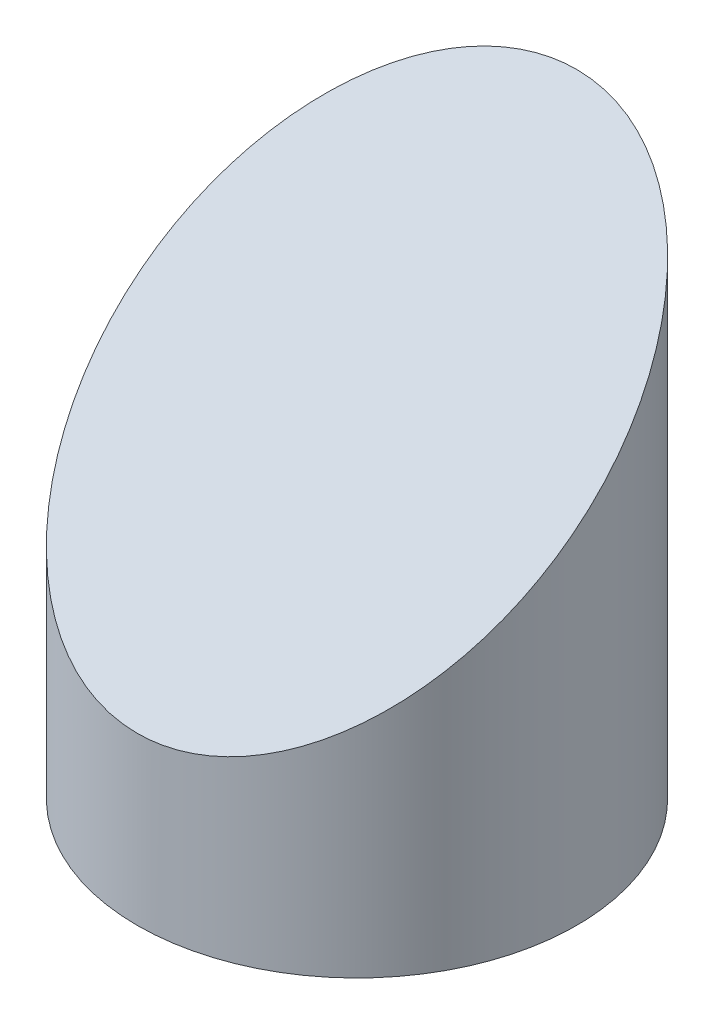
SolidWorks part; units mm, degrees
ref_plane "前视基准面" through (0, 0, 0) normal (0, 0, 1) x (1, 0, 0)
ref_plane "上视基准面" through (0, 0, 0) normal (0, 1, 0) x (1, 0, 0)
ref_plane "右视基准面" through (0, 0, 0) normal (1, 0, 0) x (0, 0, -1)
sketch "草图1" plane through (0, 0, 0) normal (1, 0, 0) x (0, 0, -1)
  line L0 (0, 0) -> (0, 70.9678) construction
  line L1 (0, 0) -> (25, 0)
  line L2 (25, 0) -> (25, 80)
  line L3 (25, 80) -> (0, 80)
  line L4 (0, 80) -> (0, 0)
  dimension "D1" = 80
  dimension "D2" = 25
revolve "旋转1" add sketch "草图1" angle 360 about L0
sketch "草图3" plane through (0, 0, 0) normal (1, 0, 0) x (0, 0, -1)
  line L0 (25, 59.3874) -> (-25, 18.9355)
  line L1 (25, 0) -> (25, 80) construction
  line L2 (-25, 80) -> (-25, 0) construction
  line L3 (-25, 18.9355) -> (-25, 91.3478)
  line L4 (-25, 91.3478) -> (25, 91.3478)
  line L5 (25, 91.3478) -> (25, 59.3874)
extrude "切除-拉伸1" cut sketch "草图3" against normal through all both and the other way through all
